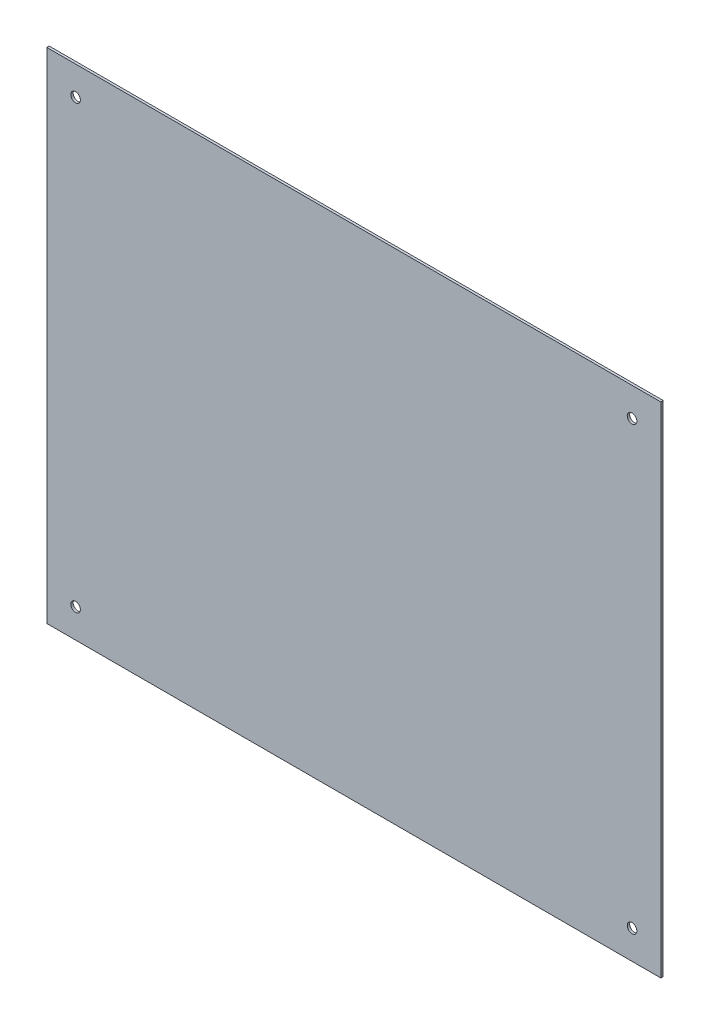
SolidWorks part; units mm, degrees
ref_plane "Front" through (0, 0, 0) normal (0, 0, 1) x (1, 0, 0)
ref_plane "Top" through (0, 0, 0) normal (0, 1, 0) x (1, 0, 0)
ref_plane "Right" through (0, 0, 0) normal (1, 0, 0) x (0, 0, -1)
sketch "Sketch1" plane through (0, 0, 0) normal (0, 0, 1) x (1, 0, 0)
  line L0 (101.6, -82.55) -> (-101.6, 82.55) construction
  line L1 (-101.6, 82.55) -> (101.6, 82.55)
  line L2 (-101.6, 82.55) -> (-101.6, -82.55)
  line L3 (-101.6, -82.55) -> (101.6, -82.55)
  line L4 (101.6, 82.55) -> (101.6, -82.55)
  dimension "D1" = 203.2
  dimension "D2" = 165.1
extrude "Base-Extrude" add sketch "Sketch1" along normal mid plane 0.7937
other "Hole1"
sketch "Sketch2" plane through (0, 0, 0.3969) normal (0, 0, 1) x (1, 0, 0)
  line L0 (101.6, 82.55) -> (-101.6, 82.55) construction
  line L1 (-101.6, 82.55) -> (-101.6, -82.55) construction
  circle A0 centre (-92.075, 73.025) radius 1.5875
  dimension "D1" = 3.175
  dimension "D2" = 9.525
  dimension "D3" = 9.525
mirror "Mirror1" about plane through (0, 0, 0) normal (0, 1, 0) of "Hole1"
mirror "Mirror2" about plane through (0, 0, 0) normal (1, 0, 0) of "Mirror1", "Hole1"
